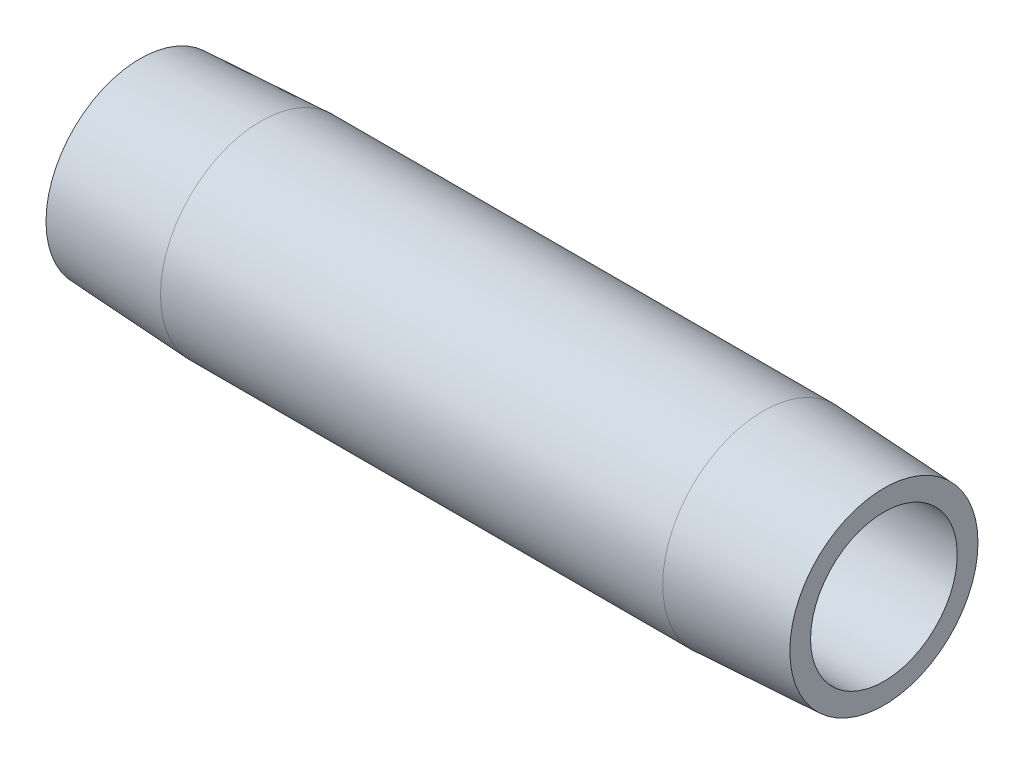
SolidWorks part; units mm, degrees
ref_plane "Front Plane" through (0, 0, 0) normal (0, 0, 1) x (1, 0, 0)
ref_plane "Top Plane" through (0, 0, 0) normal (0, 1, 0) x (1, 0, 0)
ref_plane "Right Plane" through (0, 0, 0) normal (1, 0, 0) x (0, 0, -1)
sketch "Sketch1" plane through (0, 0, 0) normal (0, 0, 1) x (1, 0, 0)
  line L5 (63.5, 6.2611) -> (0, 6.2611)
  line L6 (53.1876, 8.5725) -> (10.3124, 8.5725)
  line L7 (10.3124, 8.5725) -> (0, 8.0321)
  line L8 (63.5, 8.0321) -> (53.1876, 8.5725)
  line L9 (63.5, 6.2611) -> (63.5, 8.0321)
  line L10 (0, 6.2611) -> (0, 8.0321)
  line L11 (0, 0) -> (50000, 0) construction
  line L12 (0, -55) -> (0, 55) construction
  dimension "D1" = 12.5222
  dimension "D2" = 17.145
  dimension "D3" = 3
  dimension "D4" = 3
  dimension "D5" = 63.5
  dimension "D6" = 10.3124
  dimension "D7" = 10.3124
revolve "Revolve1" add sketch "Sketch1" angle 360 about L11
